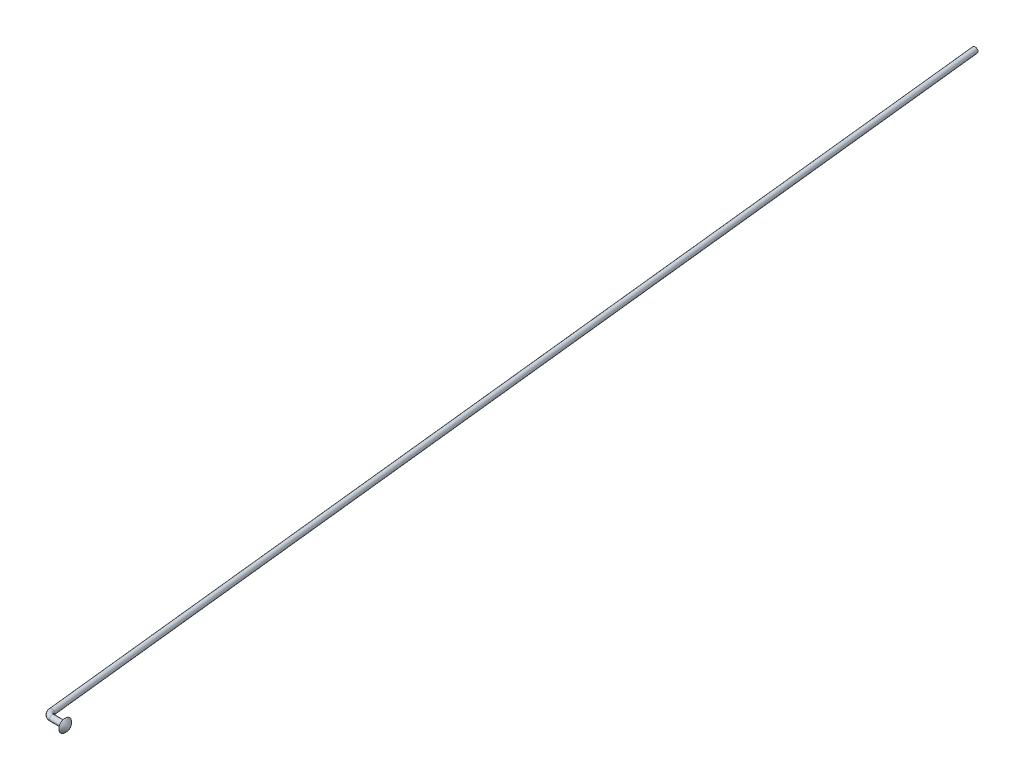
SolidWorks part; units mm, degrees
ref_plane "Front Plane" through (0, 0, 0) normal (0, 0, 1) x (1, 0, 0)
ref_plane "Top Plane" through (0, 0, 0) normal (0, 1, 0) x (1, 0, 0)
ref_plane "Right Plane" through (0, 0, 0) normal (1, 0, 0) x (0, 0, -1)
ref_plane "Plane1" through (0, 0, 4.5) normal (0, 0, 1) x (1, 0, 0)
sketch "spita" plane through (0, 0, 0) normal (0, 1, 0) x (1, 0, 0)
  line L0 (-0.7339, -277.9826) -> (-30.7, 0)
  line L1 (4.2278, -279.3291) -> (0.7583, -279.3291)
  line L2 (5.0134, -279.3291) -> (2.0134, -279.3291) construction
  line L3 (-30.7, -200.1597) -> (-30.7, 0) construction
  line L4 (-55, 0) -> (55, 0) construction
  line L5 (-30.7, 0) -> (-30.7, -5.8165) construction
  arc A0 (-0.7339, -277.9826) -> (0.7583, -279.3291) centre (0.7583, -277.8291) ccw
  point P6 (0, 0)
  dimension "D1" = 1.5
  dimension "D2" = 3.4696
  dimension "D3" = 30.7
sketch "Sketch2" plane through (0, 0, 0) normal (0, 0, 1) x (1, 0, 0)
  line L0 (-0.7339, 0) -> (-30.7, 0) construction
  circle A0 centre (-30.7, 0) radius 0.75
  dimension "D1" = 1.5
  dimension "D2" = 30.7
sketch "Sketch3" plane through (0, 0, 0) normal (0, 1, 0) x (1, 0, 0)
  line L0 (4.2278, -279.3291) -> (4.2278, -277.6291)
  line L2 (4.2278, -279.3291) -> (5.2278, -279.3291)
  arc A0 (4.2278, -277.6291) -> (5.2278, -279.3291) centre (2.2857, -279.9156) cw
  dimension "D1" = 3
  dimension "D2" = 1.7
  dimension "D3" = 1
ref_plane "Piano1" through (4.2278, 0, 279.3291) normal (1, 0, 0) x (0, 0, -1)
sketch "Schizzo5" plane through (4.2278, 0, 279.3291) normal (1, 0, 0) x (0, 0, -1)
  line L0 (1.3464, 0) -> (0, 0) construction
  line L1 (0, 0) -> (1.7, 0) construction
  circle A0 centre (0, 0) radius 0.75
  point P6 (0.0633, 0)
  point P7 (0, 0)
  point P8 (0, 0)
  dimension "D1" = 1.5
sweep "Sweep2" add profiles "Schizzo5" path "spita"
revolve "Rivoluzione1" add sketch "Sketch3" angle 360 about L1
